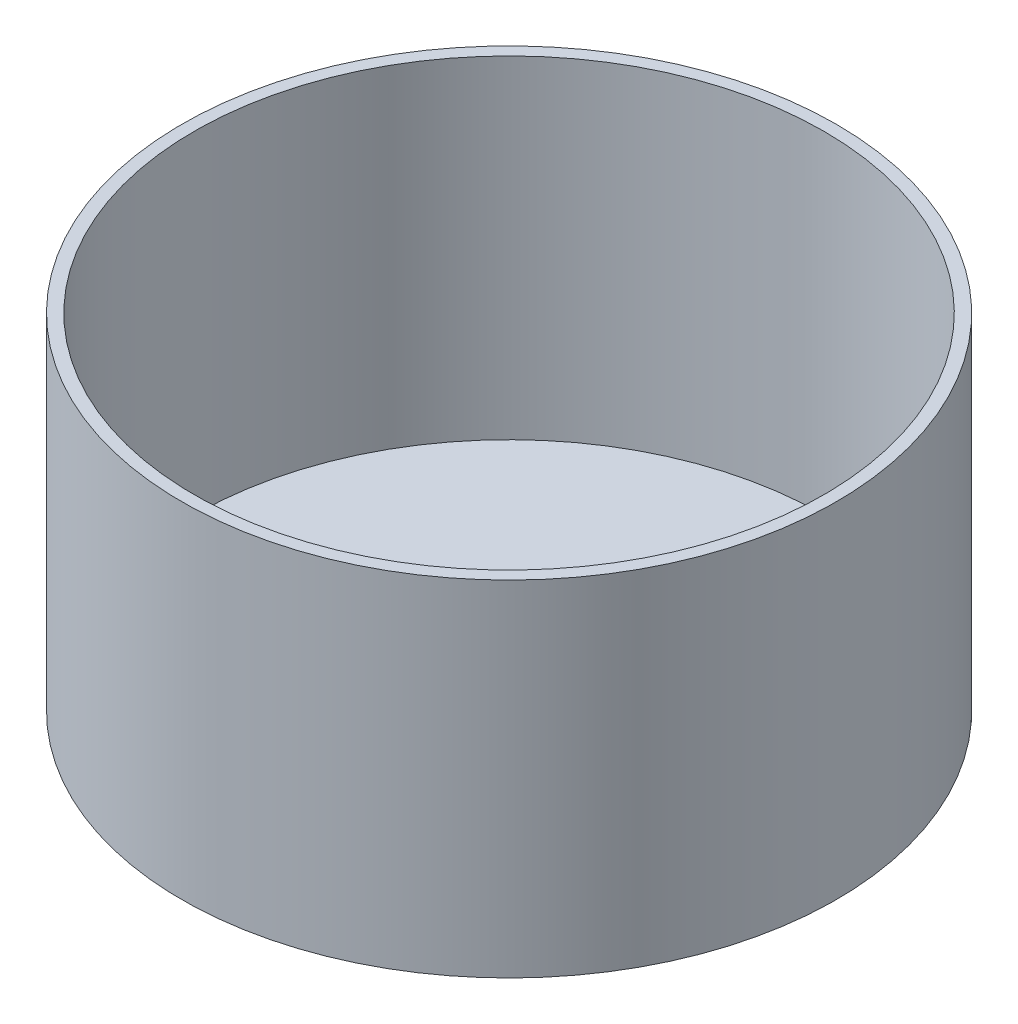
SolidWorks part; units mm, degrees
ref_plane "Ebene vorne" through (0, 0, 0) normal (0, 0, 1) x (1, 0, 0)
ref_plane "Ebene oben" through (0, 0, 0) normal (0, 1, 0) x (1, 0, 0)
ref_plane "Ebene rechts" through (0, 0, 0) normal (1, 0, 0) x (0, 0, -1)
sketch "Skizze1" plane through (0, 0, 0) normal (0, 0, 1) x (1, 0, 0)
  line L0 (-800, 842.7909) -> (-800, 0)
  line L1 (-800, 0) -> (0, 0)
  line L2 (0, 0) -> (0, 842.7909) construction
  dimension "D1" = 1600
revolve "Rotation-Dünn1" add sketch "Skizze1" angle 360 about L2
equation "\"LÄNGE\"=0"
equation "\"BREITE\"=0"
equation "\"HÖHE\"=0"
equation "\"DURCHMESSER\"=0"
equation "\"Stückzahl\"= 1"
